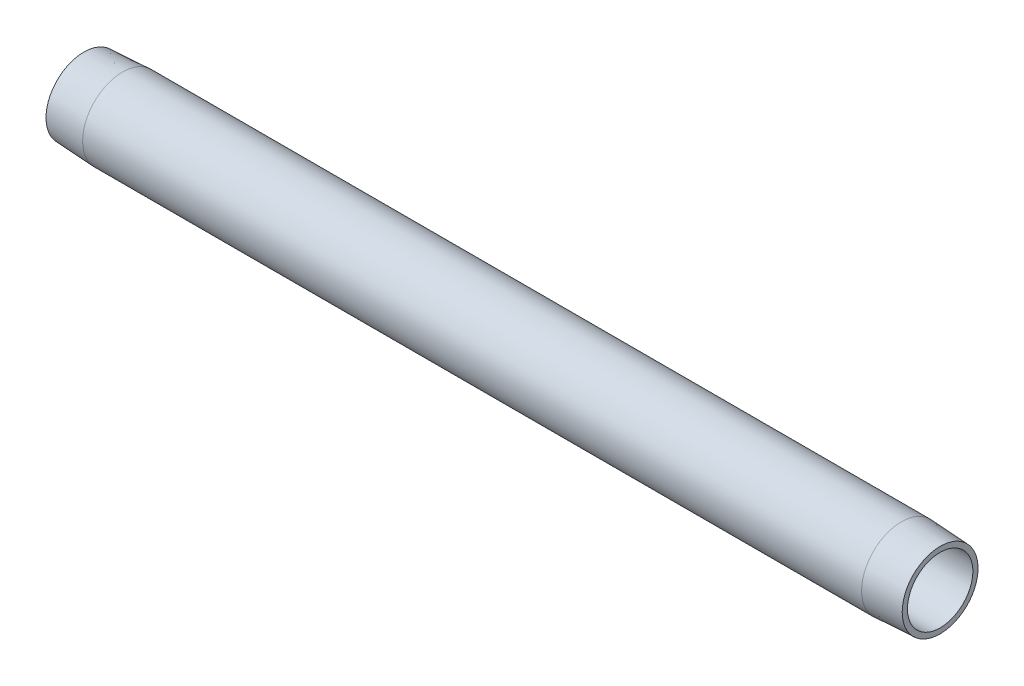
SolidWorks part; units mm, degrees
ref_plane "Front Plane" through (0, 0, 0) normal (0, 0, 1) x (1, 0, 0)
ref_plane "Top Plane" through (0, 0, 0) normal (0, 1, 0) x (1, 0, 0)
ref_plane "Right Plane" through (0, 0, 0) normal (1, 0, 0) x (0, 0, -1)
sketch "Sketch1" plane through (0, 0, 0) normal (0, 0, 1) x (1, 0, 0)
  line L6 (228.6, 8.7313) -> (0, 8.7313)
  line L7 (10.3124, 10.668) -> (0, 10.1276)
  line L8 (218.2876, 10.668) -> (10.3124, 10.668)
  line L9 (228.6, 10.1276) -> (218.2876, 10.668)
  line L10 (228.6, 8.7313) -> (228.6, 10.1276)
  line L11 (0, 10.1276) -> (0, 8.7313)
  line L12 (0, 0) -> (50000, 0) construction
  line L13 (0, -55) -> (0, 55) construction
  dimension "D1" = 228.6
  dimension "D2" = 3
  dimension "D3" = 3
  dimension "D4" = 21.336
  dimension "D5" = 17.4625
  dimension "D6" = 10.3124
  dimension "D7" = 10.3124
revolve "Revolve1" add sketch "Sketch1" angle 360 about L12
